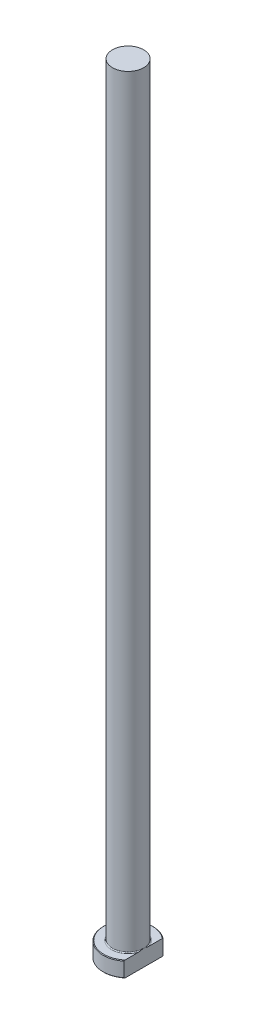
SolidWorks part; units mm, degrees
ref_plane "Front Plane" through (0, 0, 0) normal (0, 0, 1) x (1, 0, 0)
ref_plane "Top Plane" through (0, 0, 0) normal (0, 1, 0) x (1, 0, 0)
ref_plane "Right Plane" through (0, 0, 0) normal (1, 0, 0) x (0, 0, -1)
sketch "Sketch1" plane through (0, 0, 0) normal (0, 0, 1) x (1, 0, 0)
  line L0 (0, 259.9588) -> (0, -15.1925) construction
  line L1 (0, 0) -> (-8, 0)
  line L2 (-8, 0) -> (-8, 5)
  line L3 (-8, 5) -> (-5, 5)
  line L4 (-5, 5) -> (-5, 250)
  line L5 (-5, 250) -> (0, 250)
  line L6 (0, 250) -> (0, 0)
  dimension "L" = 250
  dimension "H" = 16
  dimension "T" = 5
  dimension "D" = 10
revolve "Revolve1" add sketch "Sketch1" angle 360 about L0
chamfer "Chamfer1" distance 0.2 angle 45 2 edges at (0, 5, 8) (0, 0, 8)
fillet "Fillet1" radius 0.3 1 edges at (0, 5, 5)
sketch "Sketch2" plane through (0, 0, 0) normal (0, 1, 0) x (1, 0, 0)
  line L0 (5, 6.245) -> (5, -6.245)
  circle A0 centre (0, 0) radius 8 construction
  arc A1 (5, -6.245) -> (5, 6.245) centre (0, 0) ccw
  circle A2 centre (0, 0) radius 5 construction
extrude "KEY" cut sketch "Sketch2" along normal through all
